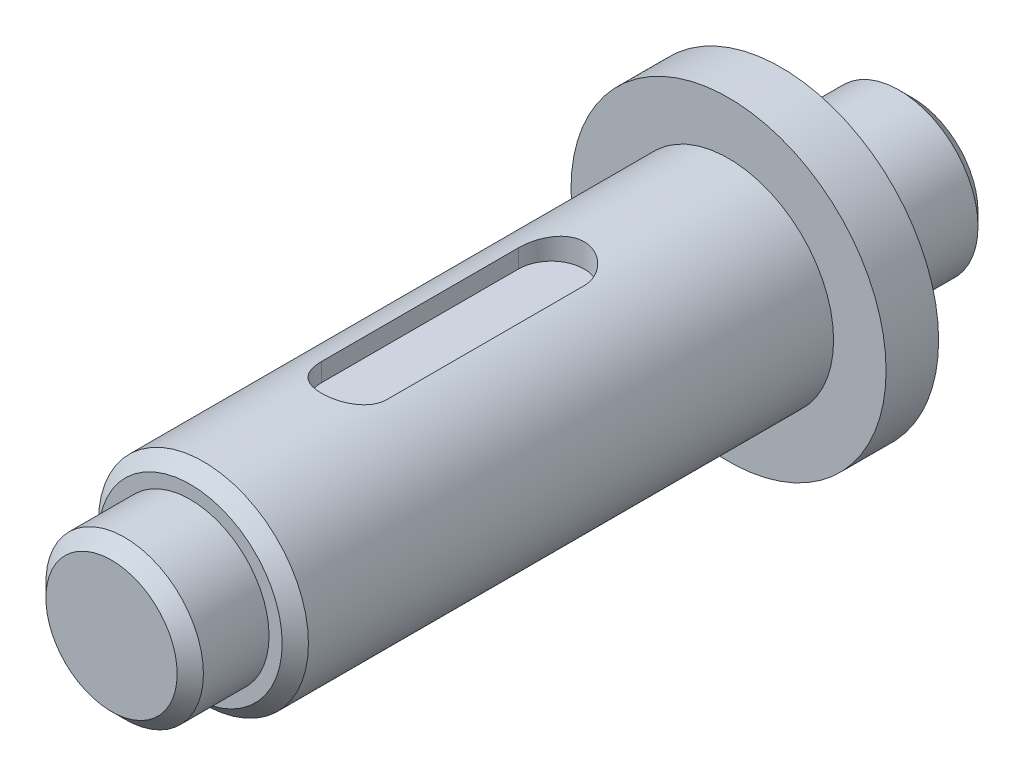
SolidWorks part; units mm, degrees
ref_plane "Ön Düzlem" through (0, 0, 0) normal (0, 0, 1) x (1, 0, 0)
ref_plane "Üst Düzlem" through (0, 0, 0) normal (0, 1, 0) x (1, 0, 0)
ref_plane "Sağ Düzlem" through (0, 0, 0) normal (1, 0, 0) x (0, 0, -1)
sketch "Sketch1" plane through (0, 0, 0) normal (0, 0, 1) x (1, 0, 0)
  circle A0 centre (0, 0) radius 6
  dimension "D1" = 12
extrude "Boss-Extrude1" add sketch "Sketch1" along normal blind 10
sketch "Sketch2" plane through (0, 0, 10) normal (0, 0, 1) x (1, 0, 0)
  circle A0 centre (0, 0) radius 12
  dimension "D1" = 24
extrude "Boss-Extrude2" add sketch "Sketch2" along normal blind 4
sketch "Sketch3" plane through (0, 0, 14) normal (0, 0, 1) x (1, 0, 0)
  circle A0 centre (0, 0) radius 8
  dimension "D1" = 16
extrude "Boss-Extrude3" add sketch "Sketch3" along normal blind 41
sketch "Sketch4" plane through (0, 0, 55) normal (0, 0, 1) x (1, 0, 0)
  circle A0 centre (0, 0) radius 6
  dimension "D1" = 12
extrude "Boss-Extrude4" add sketch "Sketch4" along normal blind 6
chamfer "Chamfer2" distance 1 angle 45 3 edges at (6, 0, 0) (8, 0, 55) (6, 0, 61)
sketch "Sketch221" plane through (2.0592, 2.7854, 61) normal (0, 0, 1) x (1, 0, 0)
  line L0 (-2.0592, 5.2146) -> (-2.0592, -2.7854) construction
  line L1 (-2.0592, -2.7854) -> (-2.0592, 5.2146) construction
  circle A0 centre (-2.0592, -2.7854) radius 8 construction
  circle A2 centre (-2.0592, -2.7854) radius 8
  dimension "Angle from vertical" = 360
ref_plane "Plane1" through (0, 8, 61) normal (0, -1, 0) x (-1, 0, 0)
sketch "Sketch321" plane through (-1.0296, 8, 61) normal (0, -1, 0) x (0, 0, 1)
  line L0 (-18.5, -1.0296) -> (-33.5, -1.0296) construction
  line L1 (-18.5, 1.4704) -> (-33.5, 1.4704)
  line L2 (-18.5, -3.5296) -> (-33.5, -3.5296)
  arc A0 (-18.5, 1.4704) -> (-18.5, -3.5296) centre (-18.5, -1.0296) cw
  arc A1 (-33.5, 1.4704) -> (-33.5, -3.5296) centre (-33.5, -1.0296) ccw
  dimension "Keyway width" = 5
  dimension "Distance from end face" = 18.5
  dimension "Length of slot" = 15
extrude "Cut-Extrude1" cut sketch "Sketch321" along normal blind 1.8
other "keyway (bs 4235 - part i)<1>"
